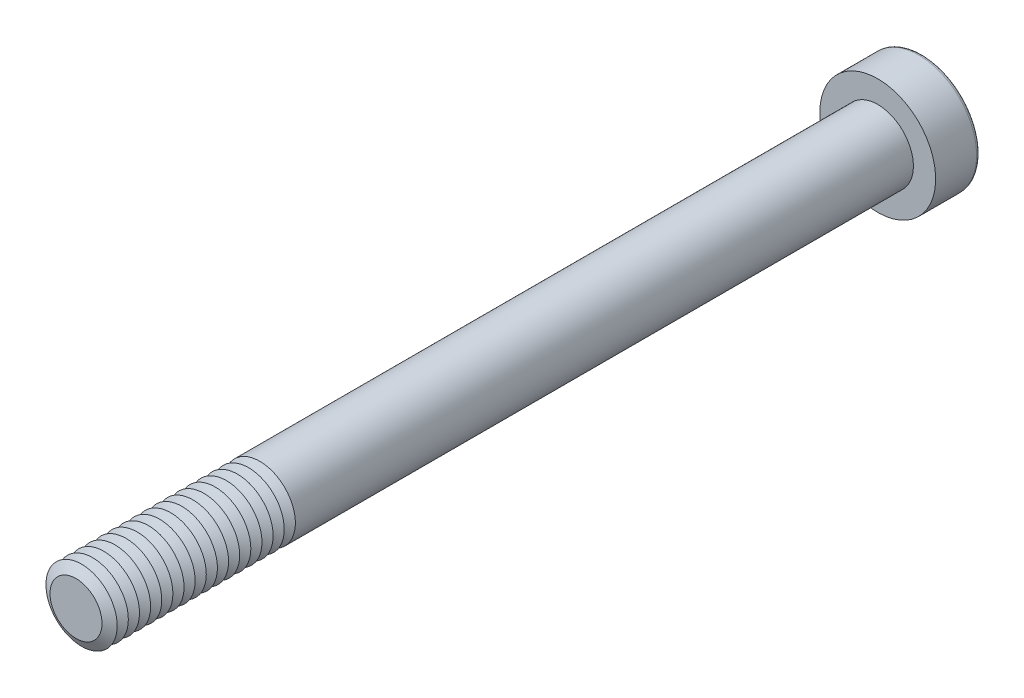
SolidWorks part; units mm, degrees
ref_plane "Front Plane" through (0, 0, 0) normal (0, 0, 1) x (1, 0, 0)
ref_plane "Top Plane" through (0, 0, 0) normal (0, 1, 0) x (1, 0, 0)
ref_plane "Right Plane" through (0, 0, 0) normal (1, 0, 0) x (0, 0, -1)
sketch "Sketch1" plane through (0, 0, 0) normal (0, 0, 1) x (1, 0, 0)
  circle A0 centre (0, 0) radius 4
  dimension "D1" = 8
extrude "Boss-Extrude1" add sketch "Sketch1" along normal blind 90
sketch "Sketch2" plane through (0, 0, 0) normal (0, 0, -1) x (-1, 0, 0)
  circle A0 centre (0, 0) radius 6.5
  dimension "D1" = 13
extrude "Boss-Extrude2" add sketch "Sketch2" along normal blind 5
sketch "Sketch3" plane through (0, 0, -5) normal (0, 0, -1) x (-1, 0, 0)
  line L1 (-1.4434, 2.5) -> (-2.8868, 0)
  line L2 (-2.8868, 0) -> (-1.4434, -2.5)
  line L3 (-1.4434, -2.5) -> (1.4434, -2.5)
  line L4 (1.4434, -2.5) -> (2.8868, 0)
  line L5 (2.8868, 0) -> (1.4434, 2.5)
  line L6 (1.4434, 2.5) -> (-1.4434, 2.5)
  circle A0 centre (0, 0) radius 2.5 construction
  dimension "D1" = 5
extrude "Cut-Extrude1" cut sketch "Sketch3" against normal blind 3.75
fillet "Fillet1" radius 0.4 1 edges at (-6.5, 0, -5)
sketch "Sketch4" plane through (0, 0, -1.25) normal (0, 0, -1) x (-1, 0, 0)
  line L0 (1.4434, -2.5) -> (2.8868, 0) construction
  circle A0 centre (0, 0) radius 2.5
extrude "Cut-Extrude2" cut sketch "Sketch4" against normal through all draft 60
sketch "Sketch5" plane through (0, 0, -5) normal (0, 0, -1) x (-1, 0, 0)
  circle A0 centre (0, 0) radius 2.8868
extrude "Cut-Extrude3" cut sketch "Sketch5" against normal through all draft 75
sketch "Sketch7" plane through (0, 0, 0) normal (1, 0, 0) x (0, 0, -1)
  line L25 (-90, 2.9175) -> (-89.375, 4)
  line L26 (-90, 4) -> (-90, -4) construction
  line L27 (-89.375, 4) -> (-90.625, 4)
  line L28 (-90.625, 4) -> (-90, 2.9175)
  line L29 (0, 4) -> (-90, 4) construction
  dimension "D1" = 1.25
revolve "Cut-Revolve1" cut sketch "Sketch7" angle 360 about axis through (0, 0, 90) along (0, 0, -1)
pattern_linear "LPattern1" count 17 spacing 1.25 along (0, 0, -1) of "Cut-Revolve1"
